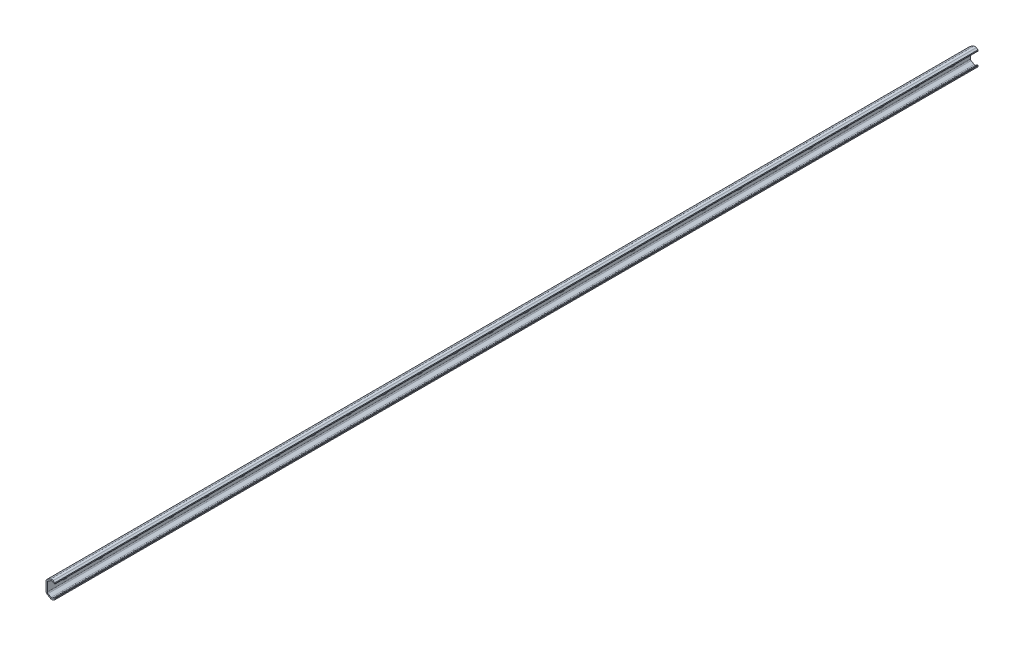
SolidWorks part; units mm, degrees
ref_plane "Front Plane" through (0, 0, 0) normal (0, 0, 1) x (1, 0, 0)
ref_plane "Top Plane" through (0, 0, 0) normal (0, 1, 0) x (1, 0, 0)
ref_plane "Right Plane" through (0, 0, 0) normal (1, 0, 0) x (0, 0, -1)
sketch "Sketch1" plane through (0, 0, 0) normal (0, 0, 1) x (1, 0, 0)
  line L0 (19.4996, 13.4748) -> (20, 14.3415)
  line L1 (20, 14.3415) -> (20, 16.65)
  line L2 (20, 16.65) -> (16.0762, 18.9154)
  line L3 (10, 18.9601) -> (3, 14.9186)
  line L4 (0, 9.7225) -> (0, 0)
  line L5 (0, 0) -> (0, -9.7225)
  line L6 (3, -14.9186) -> (10, -18.9601)
  line L7 (16.0762, -18.9154) -> (20, -16.65)
  line L8 (20, -16.65) -> (20, -14.3415)
  line L9 (20, -14.3415) -> (19.4996, -13.4748)
  line L10 (19.4996, -13.4748) -> (14.5538, -16.3303)
  line L11 (11.5, -16.3621) -> (4.5, -12.3206)
  line L12 (3, -9.7225) -> (3, 9.7225)
  line L13 (4.5, 12.3206) -> (11.5, 16.3621)
  line L14 (14.5538, 16.3303) -> (19.4996, 13.4748)
  arc A0 (16.0762, 18.9154) -> (10, 18.9601) centre (12.9987, 13.585) ccw
  arc A1 (3, 14.9186) -> (0, 9.7225) centre (6, 9.7225) ccw
  arc A2 (0, -9.7225) -> (3, -14.9186) centre (6, -9.7225) ccw
  arc A3 (10, -18.9601) -> (16.0762, -18.9154) centre (13, -13.764) ccw
  arc A4 (14.5538, -16.3303) -> (11.5, -16.3621) centre (12.9987, -13.6368) cw
  arc A5 (4.5, -12.3206) -> (3, -9.7225) centre (6, -9.7225) cw
  arc A6 (3, 9.7225) -> (4.5, 12.3206) centre (6, 9.7225) cw
  arc A7 (11.5, 16.3621) -> (14.5538, 16.3303) centre (13, 13.764) cw
  point P10 (20, -15.4957)
  dimension "D1" = 3
  dimension "D12" = 6.155
  dimension "D2" = 4.5
  dimension "D3" = 10
  dimension "D4" = 16.0762
  dimension "D5" = 9.7225
  dimension "D6" = 19.4996
  dimension "D7" = 20
  dimension "D8" = 13.4748
  dimension "D9" = 16.3621
  dimension "D10" = 16.3303
  dimension "D11" = 18.9154
  dimension "D13" = 20
extrude "Boss-Extrude1" add sketch "Sketch1" against normal blind 2080 contours L4 L5 A2 L6 A3 L7 L8 L9 L10 A4 L11 A5 L12 A6 L13 A7 L14 L0 L1 L2 A0 L3 A1
sketch "Sketch2" plane through (3, 0, 0) normal (1, 0, 0) x (0, 0, -1)
  line L0 (42, 0) -> (38, 0) construction
  line L1 (42, -4.5) -> (38, -4.5)
  line L2 (42, 4.5) -> (38, 4.5)
  arc A0 (42, -4.5) -> (42, 4.5) centre (42, 0) ccw
  arc A1 (38, 4.5) -> (38, -4.5) centre (38, 0) ccw
  point P2 (40, 0)
  point P8 (40, 4.5)
  dimension "D1" = 4
  dimension "D2" = 9
  dimension "D3" = 40
extrude "Cut-Extrude1" cut sketch "Sketch2" against normal through all
pattern_linear "LPattern1" count 26 spacing 80 along (0, 0, -1) of "Cut-Extrude1"
